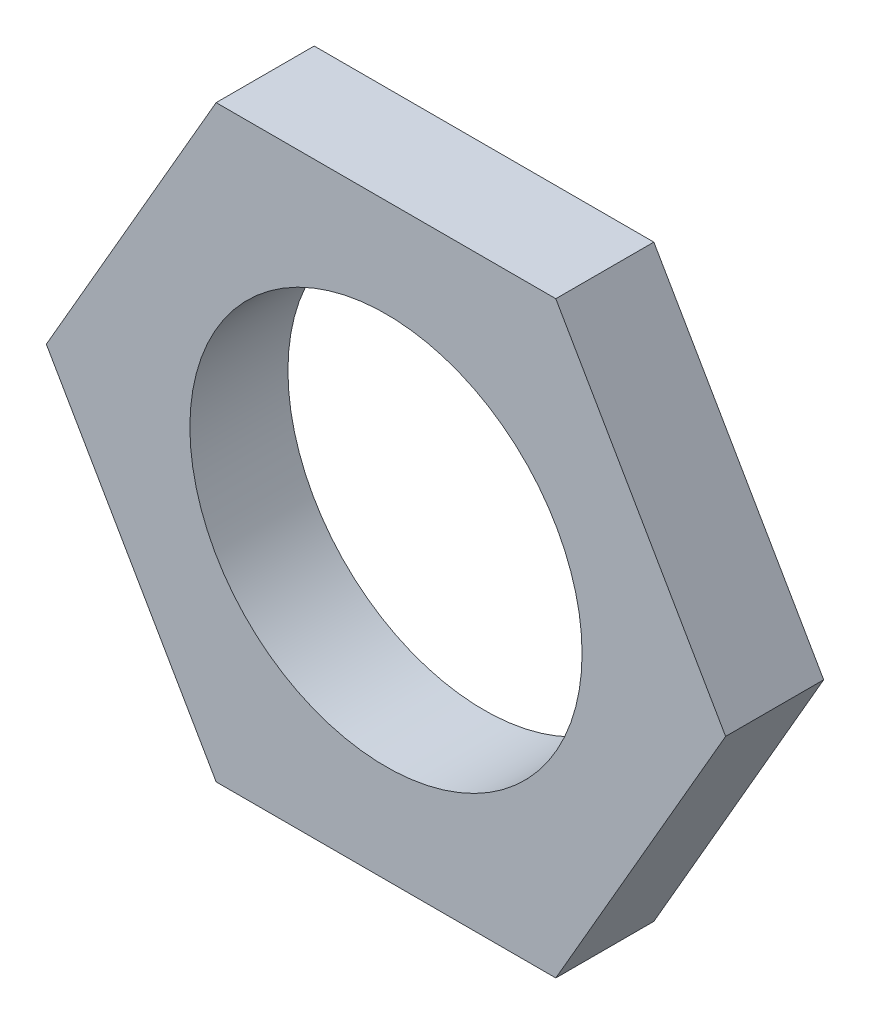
SolidWorks part; units mm, degrees
ref_plane "Front Plane" through (0, 0, 0) normal (0, 0, 1) x (1, 0, 0)
ref_plane "Top Plane" through (0, 0, 0) normal (0, 1, 0) x (1, 0, 0)
ref_plane "Right Plane" through (0, 0, 0) normal (1, 0, 0) x (0, 0, -1)
sketch "Sketch1" plane through (0, 0, 0) normal (0, 0, 1) x (1, 0, 0)
  line L1 (6.9282, 0) -> (3.4641, 6)
  line L2 (3.4641, 6) -> (-3.4641, 6)
  line L3 (-3.4641, 6) -> (-6.9282, 0)
  line L4 (-6.9282, 0) -> (-3.4641, -6)
  line L5 (-3.4641, -6) -> (3.4641, -6)
  line L6 (3.4641, -6) -> (6.9282, 0)
  circle A0 centre (0, 0) radius 6 construction
  circle A1 centre (0, 0) radius 4
  dimension "D2" = 8
  dimension "D1" = 12
extrude "Boss-Extrude1" add sketch "Sketch1" along normal blind 2
